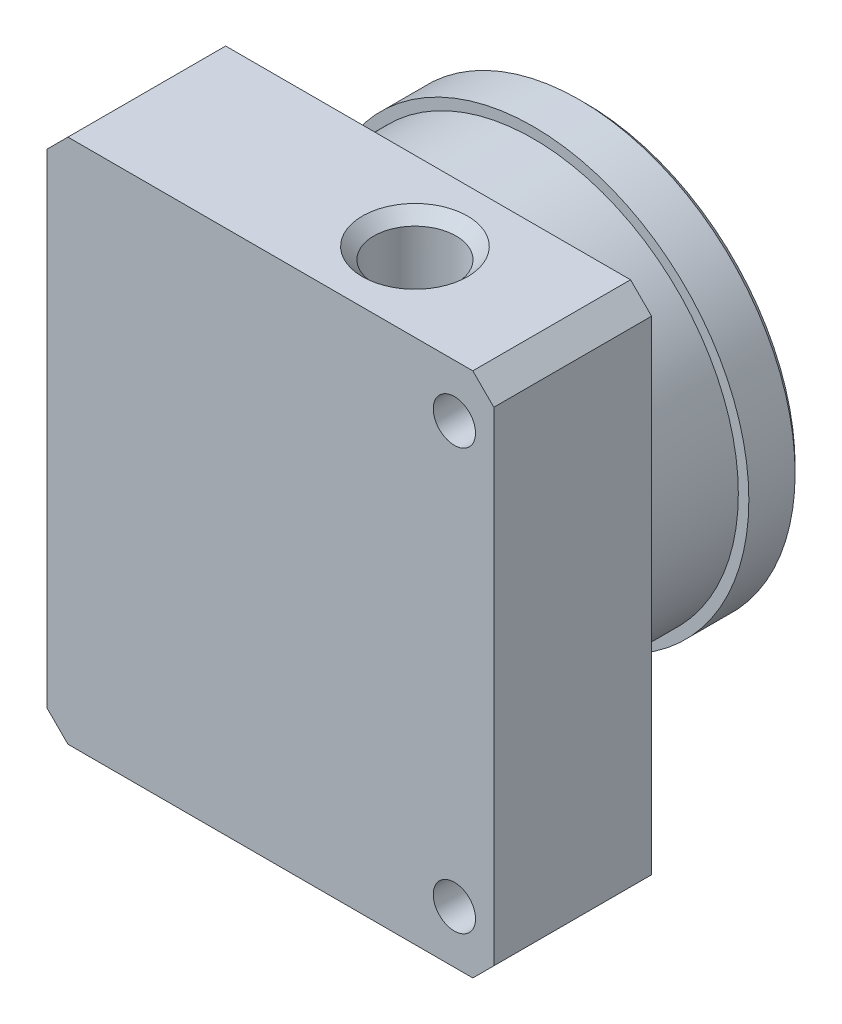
SolidWorks part; units mm, degrees
ref_plane "Front" through (0, 0, 0) normal (0, 0, 1) x (1, 0, 0)
ref_plane "Top" through (0, 0, 0) normal (0, 1, 0) x (1, 0, 0)
ref_plane "Right" through (0, 0, 0) normal (1, 0, 0) x (0, 0, -1)
sketch "Sketch1" plane through (0, 0, 0) normal (0, 0, 1) x (1, 0, 0)
  line L0 (0, 31.75) -> (0, 19.8178) construction
  line L1 (-26.9875, 31.75) -> (26.9875, 31.75)
  line L2 (-26.9875, 31.75) -> (-26.9875, -31.75)
  line L3 (26.9875, 0) -> (-38.3033, 0) construction
  line L4 (26.9875, 31.75) -> (26.9875, -31.75)
  line L5 (26.9875, -31.75) -> (-26.9875, -31.75)
  dimension "D3" = 53.975
  dimension "D4" = 63.5
extrude "body" add sketch "Sketch1" along normal blind 19.05
ref_plane "Plane2" through (0, 0, 127) normal (-1, 0, 0) x (0, 1, 0)
ref_plane "Plane3" through (0, 0, 7.62) normal (-1, 0, 0) x (0, 1, 0)
sketch "Sketch17" plane through (0, 0, 0) normal (0, 0, -1) x (-1, 0, 0)
  line L0 (0, 28.3788) -> (0, -28.9833) construction
  line L1 (-31.2476, 19.05) -> (34.6999, 19.05) construction
  circle A0 centre (-5.0038, 19.05) radius 2.3813
  circle A1 centre (5.0038, 19.05) radius 2.3813
  dimension "D1" = 10.0076
  dimension "D2" = 5.0038
  dimension "D3" = 4.7625
  dimension "D4" = 4.7625
  dimension "D5" = 19.05
extrude "internal pump ports" cut sketch "Sketch17" against normal blind 9.525
sketch "Sketch21" plane through (0, 0, 0) normal (0, 0, -1) x (-1, 0, 0)
  line L0 (0, 31.75) -> (0, -17.3751) construction
  line L1 (-26.9875, 31.75) -> (26.9875, 31.75) construction
  circle A2 centre (0, 3.175) radius 22.225
  circle A3 centre (0, 3.175) radius 26.035
  dimension "D1" = 44.45
  dimension "D2" = 28.575
  dimension "D3" = 52.07
extrude "mocap boss" add sketch "Sketch21" along normal blind 19.05
chamfer "Chamfer5" distance 0.762 angle 45 2 edges at (-22.225, 3.175, -19.05) (-26.035, 3.175, -19.05)
sketch "Sketch22" plane through (0, 0, 0) normal (0, 0, -1) x (-1, 0, 0)
  circle A1 centre (0, 3.175) radius 22.225 construction
  circle A2 centre (0, 3.175) radius 22.225
  dimension "D1" = 44.45
extrude "pump pocket" cut sketch "Sketch22" against normal blind 1.27
chamfer "block corners" distance 2.54 angle 45 4 edges at (-26.9875, -31.75, 9.525) (26.9875, -31.75, 9.525) (26.9875, 31.75, 9.525) (-26.9875, 31.75, 9.525)
sketch "Sketch23" plane through (0, -31.75, 0) normal (0, -1, 0) x (1, 0, 0)
  line L0 (7.9375, 0) -> (7.9375, 28.4514) construction
  line L2 (26.9875, 19.05) -> (26.9875, 0) construction
  line L3 (7.9375, 9.525) -> (-26.9875, 9.525) construction
  line L4 (-26.9875, 0) -> (-26.9875, 19.05) construction
  circle A0 centre (7.9375, 9.525) radius 5.5562
  circle A1 centre (7.9375, 9.525) radius 11.1125 construction
  dimension "D1" = 11.1125
  dimension "D2" = 22.225
  dimension "D4" = 19.05
extrude "MCBH hole" cut sketch "Sketch23" against normal blind 25.4
sketch "Sketch24" plane through (0, 0, 1.27) normal (0, 0, -1) x (-1, 0, 0)
  line L0 (0, 3.175) -> (0, -32.4623) construction
  line L1 (-12.7, -1.905) -> (29.0755, -1.905) construction
  line L2 (-12.7, 6.0325) -> (12.7, 6.0325)
  line L3 (-12.7, -9.8425) -> (12.7, -9.8425)
  arc A0 (-12.7, 6.0325) -> (-12.7, -9.8425) centre (-12.7, -1.905) ccw
  arc A1 (12.7, -9.8425) -> (12.7, 6.0325) centre (12.7, -1.905) ccw
  dimension "D1" = 15.875
  dimension "D2" = 15.875
  dimension "D3" = 5.08
  dimension "D4" = 25.4
  dimension "D5" = 12.7
extrude "internal wire pocket" cut sketch "Sketch24" against normal blind 10.16
sketch "Sketch25" plane through (0, 0, 0) normal (0, 0, -1) x (-1, 0, 0)
  line L0 (-43.253, 25.4) -> (-12.0506, 25.4) construction
  line L1 (-47.2254, -25.4) -> (-14.6225, -25.4) construction
  line L2 (-22.225, 41.4004) -> (-22.225, -42.5176) construction
  circle A1 centre (-22.225, 25.4) radius 2.5527
  circle A3 centre (-22.225, -25.4) radius 2.5527
  dimension "D1" = 22.225
  dimension "D5" = 5.1054
  dimension "D7" = 5.1054
  dimension "D2" = 25.4
  dimension "D3" = 50.8
extrude "mounting holes" cut sketch "Sketch25" against normal through all
sketch "Sketch27" plane through (-26.9875, 0, 0) normal (-1, 0, 0) x (0, 0, 1)
  line L1 (0, 31.75) -> (19.05, 31.75) construction
  line L2 (9.525, 31.75) -> (9.525, 11.0872) construction
  line L3 (9.525, 19.05) -> (26.5802, 19.05) construction
  line L4 (9.525, 21.4313) -> (9.525, 16.6687) construction
  circle A0 centre (9.525, 19.05) radius 2.5527
  dimension "D1" = 5.1054
extrude "outlet port" cut sketch "Sketch27" against normal blind 25.4
ref_plane "Plane4" through (4.953, 14.732, 25.3746) normal (-1, 0, 0) x (0, -1, 0)
ref_plane "Plane5" through (4.953, 14.732, 25.3746) normal (-1, 0, 0) x (0, -1, 0)
ref_axis "Axis1" through (0, 3.175, -55.7553) along (0, 0, 1)
sketch "Sketch31" plane through (0, 0, 0) normal (1, 0, 0) x (0, 0, -1)
  line L0 (18.288, 29.21) -> (0, 29.21) construction
  line L1 (0, 29.21) -> (12.7, 29.21)
  line L2 (0, 29.21) -> (0, 27.94)
  line L3 (0, 27.94) -> (12.7, 27.94)
  line L4 (12.7, 29.21) -> (12.7, 27.94)
  line L6 (19.05, -22.098) -> (19.05, 28.448) construction
  dimension "D1" = 1.27
  dimension "D2" = 6.35
revolve "clamping groove" cut sketch "Sketch31" angle 360 about axis through (0, 3.175, -55.7553) along (0, 0, 1)
sketch "Sketch32" plane through (0, -31.75, 0) normal (0, -1, 0) x (1, 0, 0)
  line L0 (7.9375, 9.525) -> (-34.0281, 9.525) construction
  line L2 (-26.9875, 0) -> (-26.9875, 19.05) construction
  circle A0 centre (-14.2875, 9.525) radius 3.4925
  dimension "D1" = 6.985
  dimension "D2" = 12.7
extrude "lure comp port" cut sketch "Sketch32" against normal blind 25.4
hole_wizard "7/16-20 Tapped Hole1" positions "Sketch34" profile "Sketch33" tap size "7/16-20" standard "ANSI Inch"
sketch "Sketch34" plane through (-26.9875, 0, 0) normal (-1, 0, 0) x (0, 0, 1)
  point P0 (9.525, 19.05)
sketch "Sketch33" plane through (-26.9875, 19.05, 9.525) normal (0, 1, 0) x (0, 0, 1)
  line L0 (0, 0) -> (0, 18.8556)
  line L1 (0, 18.8556) -> (4.9606, 15.875)
  line L2 (4.9606, 15.875) -> (4.9606, 1.3894)
  line L3 (4.9606, 1.3894) -> (6.35, 0)
  line L5 (6.35, 0) -> (0, 0)
  line L6 (-4.9606, 1.3894) -> (-6.35, 0) construction
  line L10 (0, 18.8556) -> (-4.9606, 15.875) construction
  line L11 (0, -6.35) -> (0, 107.95) construction
  dimension "Tap Drill Dia." = 9.9212
  dimension "Tap Drill Depth" = 15.875
  dimension "Near C'Sink Dia." = 12.7
  dimension "Near C'Sink Angle" = 90
  dimension "Drill Angle" = 118
hole_wizard "7/16-20 Tapped Hole2" positions "Sketch36" profile "Sketch35" tap size "7/16-20" standard "ANSI Inch"
sketch "Sketch36" plane through (0, 31.75, 0) normal (0, 1, 0) x (-1, 0, 0)
  line L0 (-26.9875, 9.525) -> (28.9134, 9.525) construction
  line L1 (-26.9875, 0) -> (-26.9875, 19.05) construction
  point P8 (-7.9375, 9.525)
  dimension "D1" = 19.05
sketch "Sketch35" plane through (7.9375, 31.75, 9.525) normal (1, 0, 0) x (0, 0, 1)
  line L0 (0, 0) -> (0, 20.7606)
  line L1 (0, 20.7606) -> (4.9606, 17.78)
  line L2 (4.9606, 17.78) -> (4.9606, 1.3894)
  line L3 (4.9606, 1.3894) -> (6.35, 0)
  line L5 (6.35, 0) -> (0, 0)
  line L6 (-4.9606, 1.3894) -> (-6.35, 0) construction
  line L10 (0, 20.7606) -> (-4.9606, 17.78) construction
  line L11 (0, -6.35) -> (0, 107.95) construction
  dimension "Tap Drill Dia." = 9.9212
  dimension "Tap Drill Depth" = 17.78
  dimension "Near C'Sink Dia." = 12.7
  dimension "Near C'Sink Angle" = 90
  dimension "Drill Angle" = 118
chamfer "Chamfer7" distance 0.508 angle 45 2 edges at (-7.3851, 19.05, 1.27) (2.6225, 19.05, 1.27)
